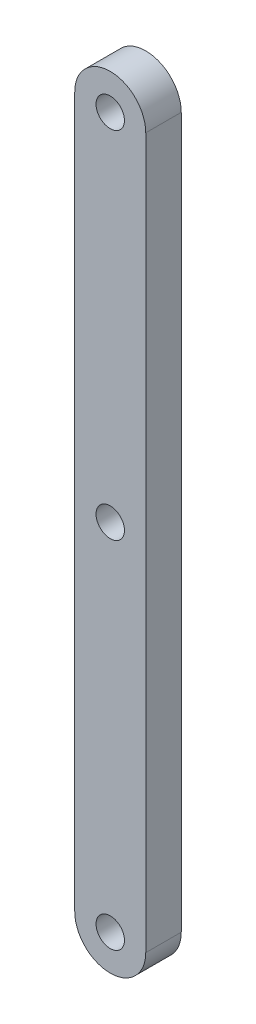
SolidWorks part; units mm, degrees
ref_plane "Front Plane" through (0, 0, 0) normal (0, 0, 1) x (1, 0, 0)
ref_plane "Top Plane" through (0, 0, 0) normal (0, 1, 0) x (1, 0, 0)
ref_plane "Right Plane" through (0, 0, 0) normal (1, 0, 0) x (0, 0, -1)
sketch "Sketch2" plane through (0, 0, 0) normal (0, 0, 1) x (1, 0, 0)
  line L0 (0, 0) -> (0, 100) construction
  line L1 (-5, 0) -> (-5, 100)
  line L2 (5, 0) -> (5, 100)
  arc A0 (-5, 0) -> (5, 0) centre (0, 0) ccw
  arc A1 (5, 100) -> (-5, 100) centre (0, 100) ccw
  circle A2 centre (0, 100) radius 2
  circle A3 centre (0, 0) radius 2
  circle A4 centre (0, 50) radius 2
  point P3 (0, 50)
  dimension "D3" = 4
  dimension "D1" = 100
  dimension "D2" = 10
extrude "Boss-Extrude1" add sketch "Sketch2" along normal blind 5
